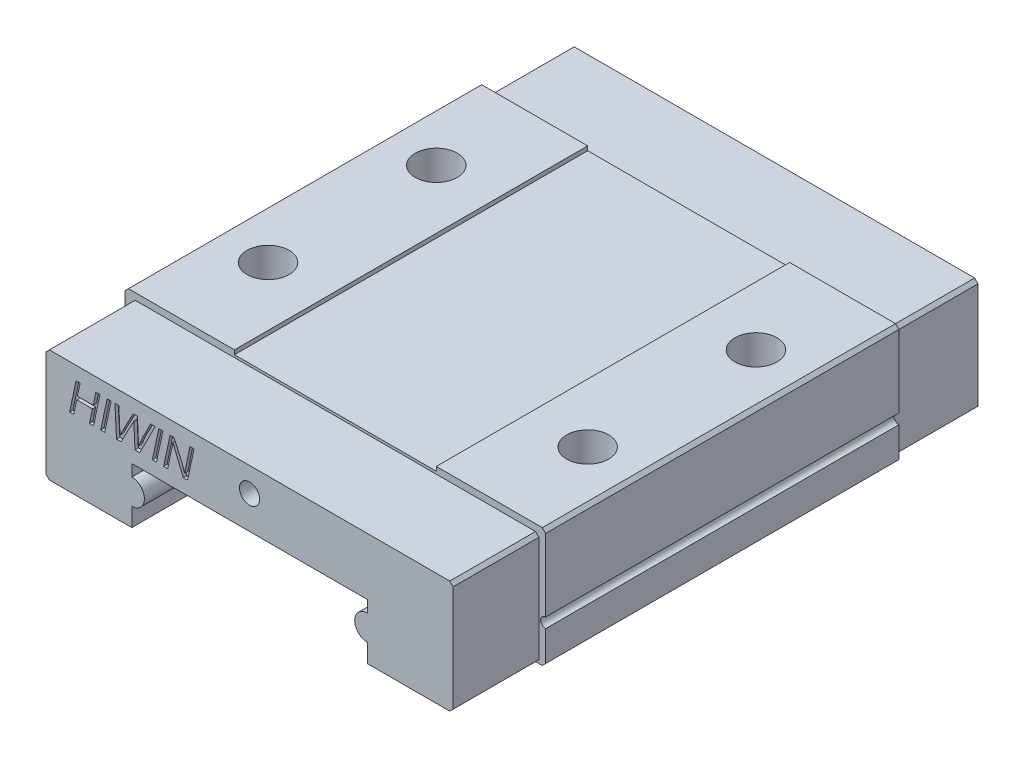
SolidWorks part; units mm, degrees
ref_plane "前视基准面" through (0, 0, 0) normal (0, 0, 1) x (1, 0, 0)
ref_plane "上视基准面" through (0, 0, 0) normal (0, 1, 0) x (1, 0, 0)
ref_plane "右视基准面" through (0, 0, 0) normal (1, 0, 0) x (0, 0, -1)
imported_body "输入2"
hole_wizard "M3 螺纹孔1" positions "草图2" profile "草图1" tap size "M3" standard "ISO"
sketch "草图2" plane through (0, 9, 0) normal (0, 1, 0) x (-1, 0, 0)
  point P1 (-9.5, 5)
  point P4 (9.5, 5)
  point P7 (9.5, -5)
  point P10 (-9.5, -5)
sketch "草图1" plane through (9.5, 9, 5) normal (1, 0, 0) x (0, 0, 1)
  line L0 (0, 0) -> (0, 5.2511)
  line L1 (0, 5.2511) -> (1.25, 4.5)
  line L2 (1.25, 4.5) -> (1.25, 0)
  line L5 (1.25, 0) -> (0, 0)
  line L10 (0, 5.2511) -> (-1.25, 4.5) construction
  line L11 (0, -6.35) -> (0, 107.95) construction
  dimension "螺纹孔钻头直径" = 2.5
  dimension "螺纹孔钻头深度" = 4.5
  dimension "导头角度" = 118
